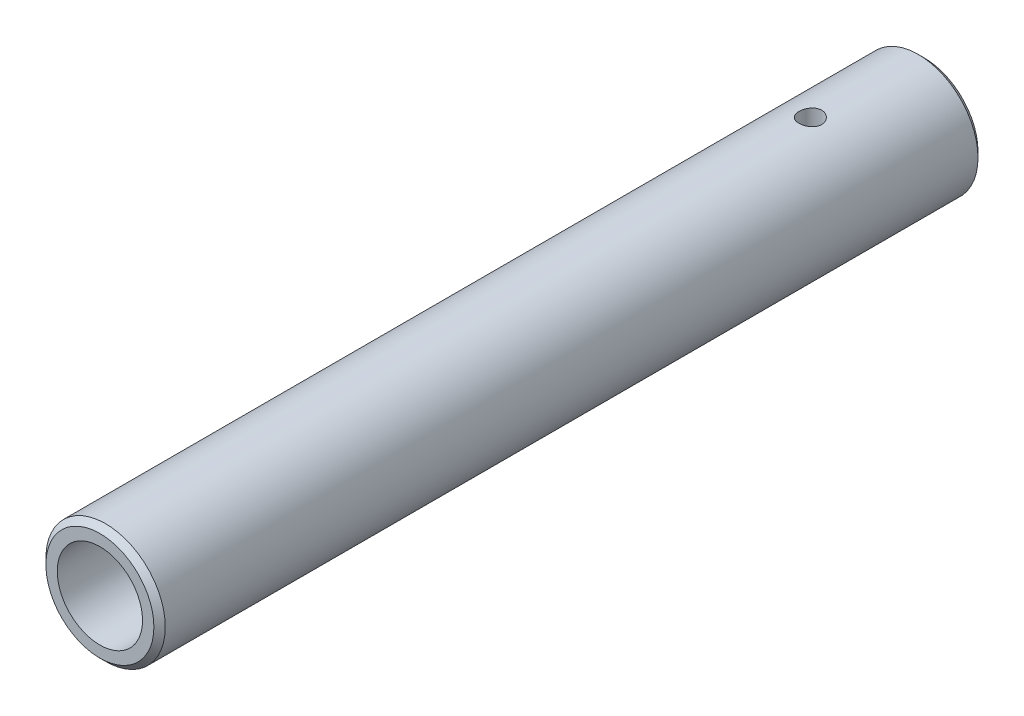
SolidWorks part; units mm, degrees
ref_plane "Face" through (0, 0, 0) normal (0, 0, 1) x (1, 0, 0)
ref_plane "Dessus" through (0, 0, 0) normal (0, 1, 0) x (1, 0, 0)
ref_plane "Droite" through (0, 0, 0) normal (1, 0, 0) x (0, 0, -1)
sketch "Esquisse1" plane through (0, 0, 0) normal (0, 0, 1) x (1, 0, 0)
  circle A0 centre (0, 0) radius 7.5
  circle A1 centre (0, 0) radius 10.5
  dimension "D1" = 21
  dimension "D2" = 15
extrude "Base-Extrusion" add sketch "Esquisse1" along normal blind 145
sketch "Esquisse2" plane through (0, 0, 0) normal (0, 1, 0) x (1, 0, 0)
  line L0 (0, -145) -> (0, 0) construction
  line L1 (10.5, 0) -> (-10.5, 0) construction
  circle A0 centre (0, -20) radius 2
  dimension "D1" = 4
  dimension "D2" = 20
extrude "Enlèv. mat.-Extru.1" cut sketch "Esquisse2" against normal through all and the other way through all
chamfer "Chanfrein1" distance 1 angle 45
